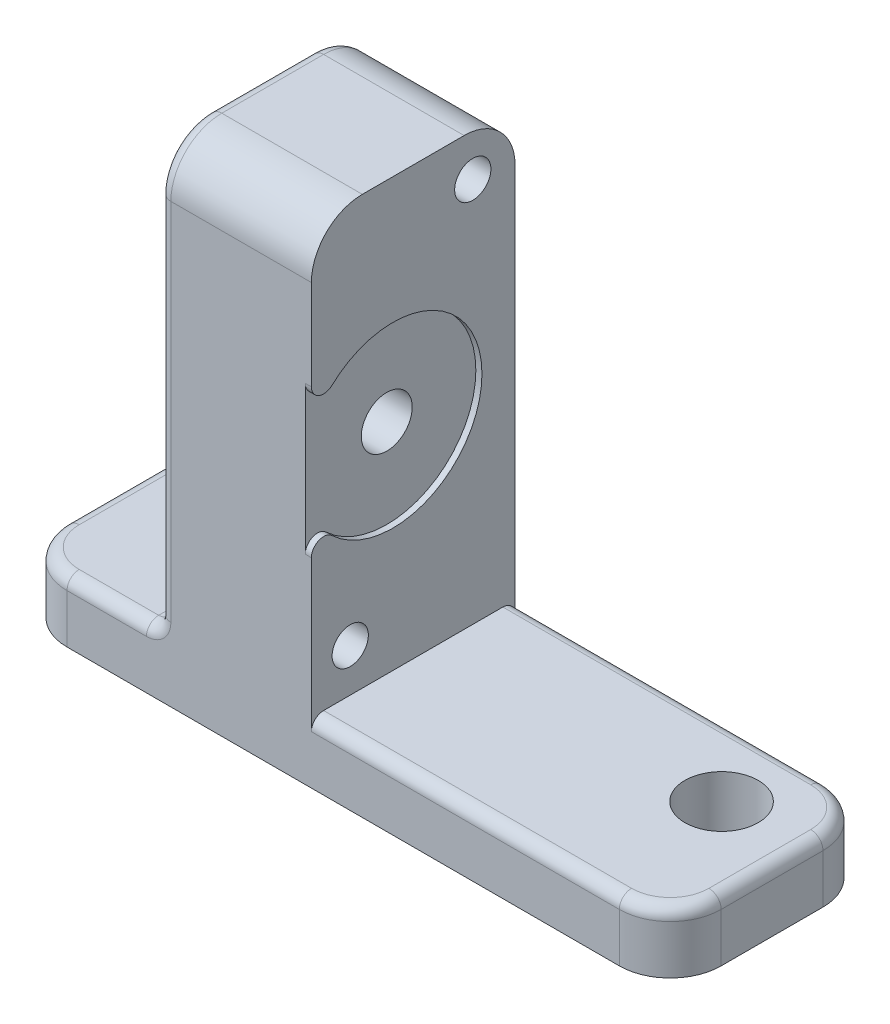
SolidWorks part; units mm, degrees
ref_plane "Front Plane" through (0, 0, 0) normal (0, 0, 1) x (1, 0, 0)
ref_plane "Top Plane" through (0, 0, 0) normal (0, 1, 0) x (1, 0, 0)
ref_plane "Right Plane" through (0, 0, 0) normal (1, 0, 0) x (0, 0, -1)
sketch "Sketch1" plane through (0, 0, 0) normal (0, 0, 1) x (1, 0, 0)
  line L0 (-20.3962, 0) -> (20.3962, 0)
  line L6 (20.3962, 3.81) -> (-1.9812, 3.81)
  line L7 (-1.9812, 3.81) -> (-1.9812, 30.48)
  line L8 (-1.9812, 30.48) -> (-11.5062, 30.48)
  line L9 (-11.5062, 30.48) -> (-11.5062, 3.81)
  line L10 (-11.5062, 3.81) -> (-20.3962, 3.81)
  line L11 (-20.3962, 3.81) -> (-20.3962, 0)
  line L12 (0, 0) -> (0, 10.2096) construction
  line L17 (20.3962, 3.81) -> (20.3962, 0)
  point P4 (0, 6.35)
  dimension "D1" = 3.9624
  dimension "D2" = 9.525
  dimension "D3" = 3.81
  dimension "D4" = 8.89
  dimension "D6" = 30.48
extrude "Boss-Extrude1" add sketch "Sketch1" along normal blind 5.08 and the other way blind 7.62
hole_wizard "1/8 (0.125) Diameter Hole1" positions "Sketch2" profile "Sketch3" hole size "1/8" standard "ANSI Inch"
sketch "Sketch2" plane through (-1.9812, 0, 0) normal (-1, 0, 0) x (0, 0, 1)
  line L0 (5.08, 0) -> (-7.62, 0) construction
  circle A0 centre (0, 17.0549) radius 7.9375 construction
  point P0 (0, 17.0549)
  dimension "D3" = 15.875
  dimension "D1" = 17.0549
sketch "Sketch3" plane through (-1.9812, 17.0549, 0) normal (0, 1, 0) x (0, 0, -1)
  line L0 (0, 0) -> (0, 5.715)
  line L1 (0, 5.715) -> (1.5875, 5.715)
  line L2 (1.5875, 5.715) -> (1.5875, 0)
  line L5 (1.5875, 0) -> (0, 0)
  line L10 (0, 5.715) -> (-1.5875, 5.715) construction
  line L11 (0, -6.35) -> (0, 107.95) construction
  dimension "Hole Dia." = 3.175
  dimension "Hole Depth" = 5.715
  dimension "Drill Angle" = 180
hole_wizard "#15 (0.18) Diameter Hole1" positions "Sketch6" profile "Sketch7" hole size "#15" standard "ANSI Inch"
sketch "Sketch6" plane through (0, 3.81, 0) normal (0, 1, 0) x (1, 0, 0)
  circle A0 centre (-15.9004, 3.175) radius 1.7272 construction
  circle A1 centre (15.3416, 3.175) radius 1.7272 construction
  point P0 (-15.9004, 3.175)
  point P2 (15.3416, 3.175)
sketch "Sketch7" plane through (-15.9004, 3.81, -3.175) normal (1, 0, 0) x (0, 0, 1)
  line L0 (0, 0) -> (0, 3.81)
  line L1 (0, 3.81) -> (2.286, 3.81)
  line L2 (2.286, 3.81) -> (2.286, 0)
  line L5 (2.286, 0) -> (0, 0)
  line L11 (0, -6.35) -> (0, 107.95) construction
  dimension "Thru Hole Dia." = 4.572
  dimension "Thru Hole Depth" = 3.81
sketch "Sketch9" plane through (-1.9812, 0, 0) normal (1, 0, 0) x (0, 0, -1)
  circle A0 centre (0, 17.0549) radius 5.5562
  circle A1 centre (0, 17.0549) radius 1.5875 construction
  dimension "D1" = 11.1125
extrude "Cut-Extrude2" cut sketch "Sketch9" against normal blind 0.381
fillet "Fillet1" radius 3.175 6 edges at (-20.3962, 1.905, -7.62) (20.3962, 1.905, -7.62) (20.3962, 1.905, 5.08) (-20.3962, 1.905, 5.08) (-6.7437, 30.48, -7.62) (-6.7437, 30.48, 5.08)
hole_wizard "#4-40 Tapped Hole1" positions "Sketch10" profile "Sketch11" tap size "#4-40" standard "ANSI Inch"
sketch "Sketch10" plane through (-11.5062, 0, 0) normal (-1, 0, 0) x (0, 0, 1)
  point P0 (-4.9838, 27.8438)
  point P3 (2.6586, 6.4854)
  point P6 (0, 17.0549)
sketch "Sketch11" plane through (-11.5062, 27.8438, -4.9838) normal (0, 1, 0) x (0, 0, 1)
  line L0 (0, 0) -> (0, 31.9024)
  line L1 (0, 31.9024) -> (1.1303, 31.9024)
  line L2 (1.1303, 31.9024) -> (1.1303, 0)
  line L5 (1.1303, 0) -> (0, 0)
  line L11 (0, -6.35) -> (0, 107.95) construction
  dimension "Thru Tap Drill Dia." = 2.2606
  dimension "Thru Tap Drill Depth" = 31.9024
fillet "Fillet2" radius 0.762 18 edges at (-20.3962, 3.81, -1.27) (-19.4663, 3.81, 4.1501) (-19.4663, 3.81, -6.6901) (-14.3637, 3.81, 5.08) (-14.3637, 3.81, -7.62) (7.62, 3.81, -7.62) (19.4663, 3.81, -6.6901) (20.3962, 3.81, -1.27) (19.4663, 3.81, 4.1501) (-11.5062, 15.5575, 5.08) (-11.5062, 29.5501, 4.1501) (-11.5062, 30.48, -1.27) (-11.5062, 29.5501, -6.6901) (7.62, 3.81, 5.08) (-11.5062, 3.81, -1.27) (-11.5062, 15.5575, -7.62) (-2.1717, 14.8042, 5.08) (-2.1717, 19.3056, 5.08)
